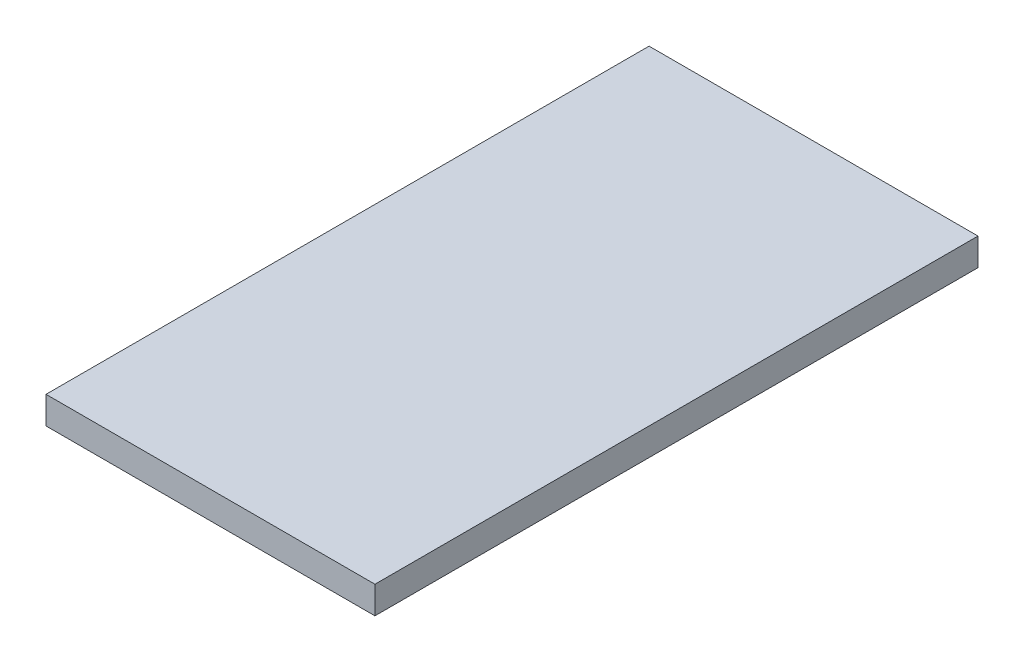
SolidWorks part; units mm, degrees
ref_plane "Front Plane" through (0, 0, 0) normal (0, 0, 1) x (1, 0, 0)
ref_plane "Top Plane" through (0, 0, 0) normal (0, 1, 0) x (1, 0, 0)
ref_plane "Right Plane" through (0, 0, 0) normal (1, 0, 0) x (0, 0, -1)
sketch "Sketch1" plane through (0, 0, 0) normal (0, 1, 0) x (1, 0, 0)
  line L1 (0, 0) -> (60, 0)
  line L2 (0, 0) -> (0, 110)
  line L3 (0, 110) -> (60, 110)
  line L4 (60, 0) -> (60, 110)
  dimension "D1" = 110
  dimension "D2" = 60
extrude "Extrude1" add sketch "Sketch1" along normal blind 5
